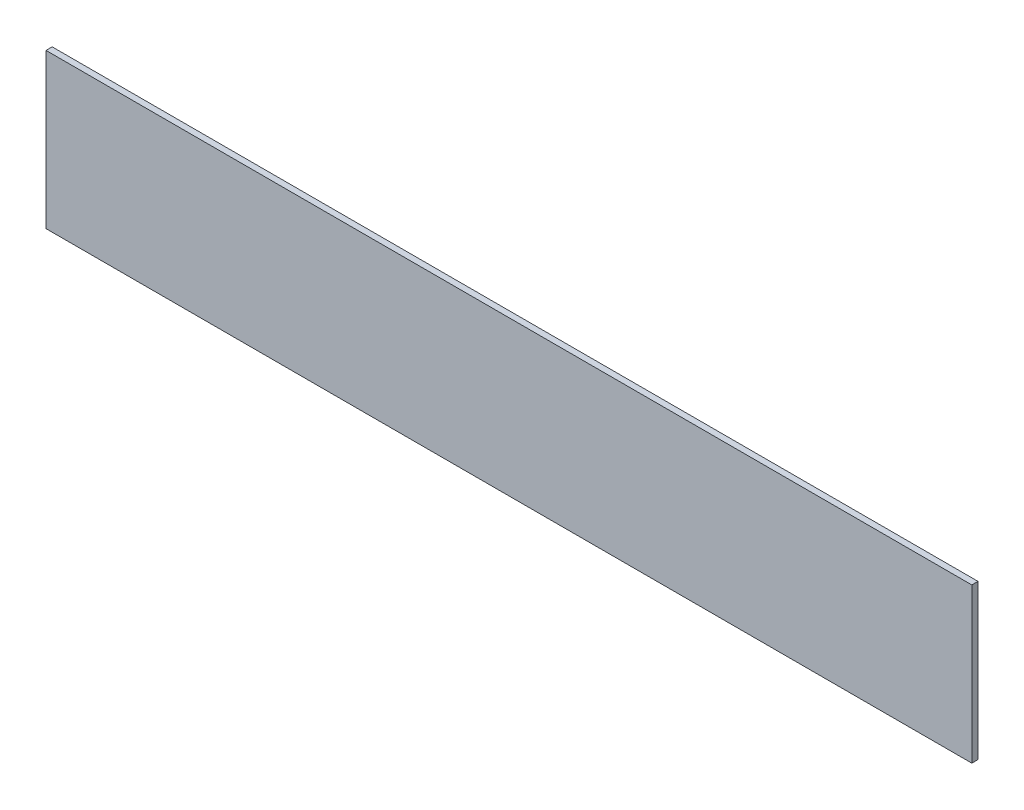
SolidWorks part; units mm, degrees
ref_plane "Plano frontal" through (0, 0, 0) normal (0, 0, 1) x (1, 0, 0)
ref_plane "Plano superior" through (0, 0, 0) normal (0, 1, 0) x (1, 0, 0)
ref_plane "Plano direito" through (0, 0, 0) normal (1, 0, 0) x (0, 0, -1)
sketch "Esboço2" plane through (0, 0, 0) normal (0, 0, 1) x (1, 0, 0)
  line L1 (-599.75, 409.6325) -> (0, 409.6325)
  line L2 (-599.75, 409.6325) -> (-599.75, 309.6325)
  line L3 (-599.75, 309.6325) -> (0, 309.6325)
  line L4 (0, 409.6325) -> (0, 309.6325)
  line L5 (-599.75, 409.6325) -> (0, 309.6325) construction
  line L6 (-599.75, 309.6325) -> (0, 409.6325) construction
  point P4 (-299.875, 359.6325)
extrude "Ressalto-extrusão1" add sketch "Esboço2" along normal blind 4
